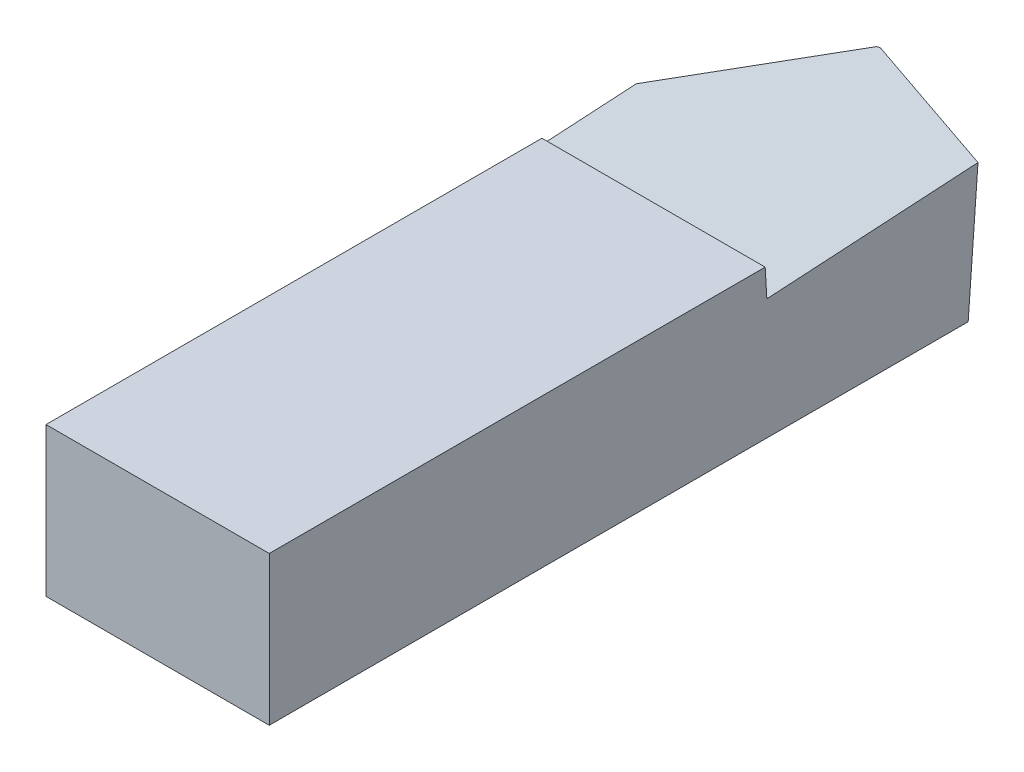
SolidWorks part; units mm, degrees
ref_plane "pi X" through (0, 0, 0) normal (0, 0, 1) x (1, 0, 0)
ref_plane "pi R" through (0, 0, 0) normal (0, 1, 0) x (1, 0, 0)
ref_plane "pi y" through (0, 0, 0) normal (1, 0, 0) x (0, 0, -1)
sketch "Sketch7" plane through (0, 0, 0) normal (0, 0, 1) x (1, 0, 0)
  line L0 (58.4265, 0) -> (-58.4265, 0) construction
  line L1 (-11.9413, 0) -> (18.0587, 0)
  line L2 (-11.9413, 0) -> (-11.9413, -20)
  line L3 (-11.9413, -20) -> (18.0587, -20)
  line L4 (18.0587, 0) -> (18.0587, -20)
extrude "Boss-Extrude2" add sketch "Sketch7" along normal blind 100
sketch "Sketch8" plane through (0, 0, 0) normal (0, 1, 0) x (1, 0, 0)
  line L0 (0, 0) -> (-11.9413, -20.6829)
  line L1 (-11.9413, -100) -> (-11.9413, 0) construction
  line L2 (0, 0) -> (18.0587, -4.8388)
  line L3 (18.0587, -100) -> (18.0587, 0) construction
  line L4 (-40.9745, 0) -> (40.9745, 0) construction
sketch "Sketch9" plane through (0, 0, 0) normal (0, 0, 1) x (1, 0, 0)
  line L0 (0, 0) -> (4.9175, -40.05)
  line L1 (0, 0) -> (39.1813, -6.9087)
  line L2 (0, -34.2304) -> (0, 34.2304) construction
  line L3 (58.4265, 0) -> (-58.4265, 0) construction
sketch "Sketch10" plane through (0, 0, 0) normal (1, 0, 0) x (0, 0, -1)
  line L0 (0, 0) -> (-5.5574, -52.8751)
  line L1 (0, 0) -> (-36.6825, -5.1554)
  line L2 (58.4265, 0) -> (-58.4265, 0) construction
  line L3 (0, 0) -> (0, -40.05) construction
sketch3d "3DSketch1"
  line L0 (4.9175, -40.05, 0) -> (4.9175, -40.05, 4.2094)
  line L1 (4.9175, -40.05, 4.2094) -> (0, -40.05, 4.2094)
  line L2 (0, 0, 0) -> (0, -52.8751, 5.5574) construction
  line L3 (0, 0, 0) -> (4.9175, -40.05, 4.2094)
ref_plane "principal flange" through (0, 0, 0) normal (-0.8553, -0.1569, -0.4938) x (-0.4857, -0.0891, 0.8696)
sketch3d "3DSketch2"
  line L0 (18.0587, 0, 4.8388) -> (18.0587, -3.1842, 4.8388)
  line L1 (18.0587, -3.1842, 4.8388) -> (18.0587, -3.1842, 0)
  line L2 (0, 0, 0) -> (39.1813, -6.9087, 0) construction
  line L3 (0, 0, 0) -> (18.0587, -3.1842, 4.8388)
ref_plane "auxialari " through (0, 0, 0) normal (0.2464, -0.0713, -0.9665) x (-0.9692, -0.0181, -0.2457)
sketch3d "3DSketch3"
  line L0 (0, -4.8812, 34.7319) -> (37.7089, -4.8812, 34.7319)
  line L2 (0, 0, 0) -> (0, -5.1554, 36.6825) construction
  line L3 (27.6829, -4.8812, 0) -> (27.6829, -4.8812, 34.7319)
  line L4 (0, 0, 0) -> (39.1813, -6.9087, 0) construction
  line L5 (0, 0, 0) -> (27.6829, -4.8812, 34.7319)
ref_plane "rake" through (0, 0, 0) normal (0.1016, 0.9931, 0.0586) x (0.9948, -0.1014, -0.006)
sketch "Sketch11" plane through (0, 0, 0) normal (0.2464, -0.0713, -0.9665) x (-0.9692, -0.0181, -0.2457)
  line L1 (-66.4667, 23.863) -> (44.8525, 23.863)
  line L2 (-66.4667, 23.863) -> (-66.4667, -64.0072)
  line L3 (-66.4667, -64.0072) -> (44.8525, -64.0072)
  line L4 (44.8525, 23.863) -> (44.8525, -64.0072)
extrude "Cut-Extrude3" cut sketch "Sketch11" along normal blind 70
sketch "Sketch12" plane through (0, 0, 0) normal (-0.8553, -0.1569, -0.4938) x (-0.4857, -0.0891, 0.8696)
  line L1 (-41.4041, 61.581) -> (72.4797, 61.581)
  line L2 (-41.4041, 61.581) -> (-41.4041, -65.7837)
  line L3 (-41.4041, -65.7837) -> (72.4797, -65.7837)
  line L4 (72.4797, 61.581) -> (72.4797, -65.7837)
extrude "Cut-Extrude4" cut sketch "Sketch12" along normal blind 70
sketch "Sketch13" plane through (0, 0, 0) normal (0.1016, 0.9931, 0.0586) x (0.9948, -0.1014, -0.006)
  line L1 (64.8472, 43.128) -> (-42.1323, 43.128)
  line L2 (64.8472, 43.128) -> (64.8472, -33.3026)
  line L3 (64.8472, -33.3026) -> (-42.1323, -33.3026)
  line L4 (-42.1323, 43.128) -> (-42.1323, -33.3026)
extrude "Cut-Extrude5" cut sketch "Sketch13" along normal blind 70
fillet "Fillet1" radius 0.4921 1 edges at (1.2278, -10, 1.051)
equation "\"γx\"= 10deg"
equation "\"γy\" = - 8deg"
equation "\"αx\" = 7deg"
equation "\"αy'\"= 6deg"
equation "\"φe\" = 15deg"
equation "\"φs\"= 30deg"
equation "\"r\"= 1 / 8in"
equation "\"D2@Sketch8\"=\"φe\""
equation "\"D1@Sketch8\"=\"φs\""
equation "\"D1@Sketch9\"=\"αx\""
equation "\"D2@Sketch9\"=\"γx\""
equation "\"D2@Sketch10\"=\"αy'\"'''''''"
equation "\"D1@Sketch10\"=-\"γy\""
equation "\"D1@Fillet1\"=\"r\""
equation "\"l\" = 10cm"
equation "\"b\"=2"
equation "\"D1@Sketch7\"=\"b\""
equation "\"w\"=3"
equation "\"D2@Sketch7\"=\"w\""
equation "\"D1@Boss-Extrude2\"=\"l\""
